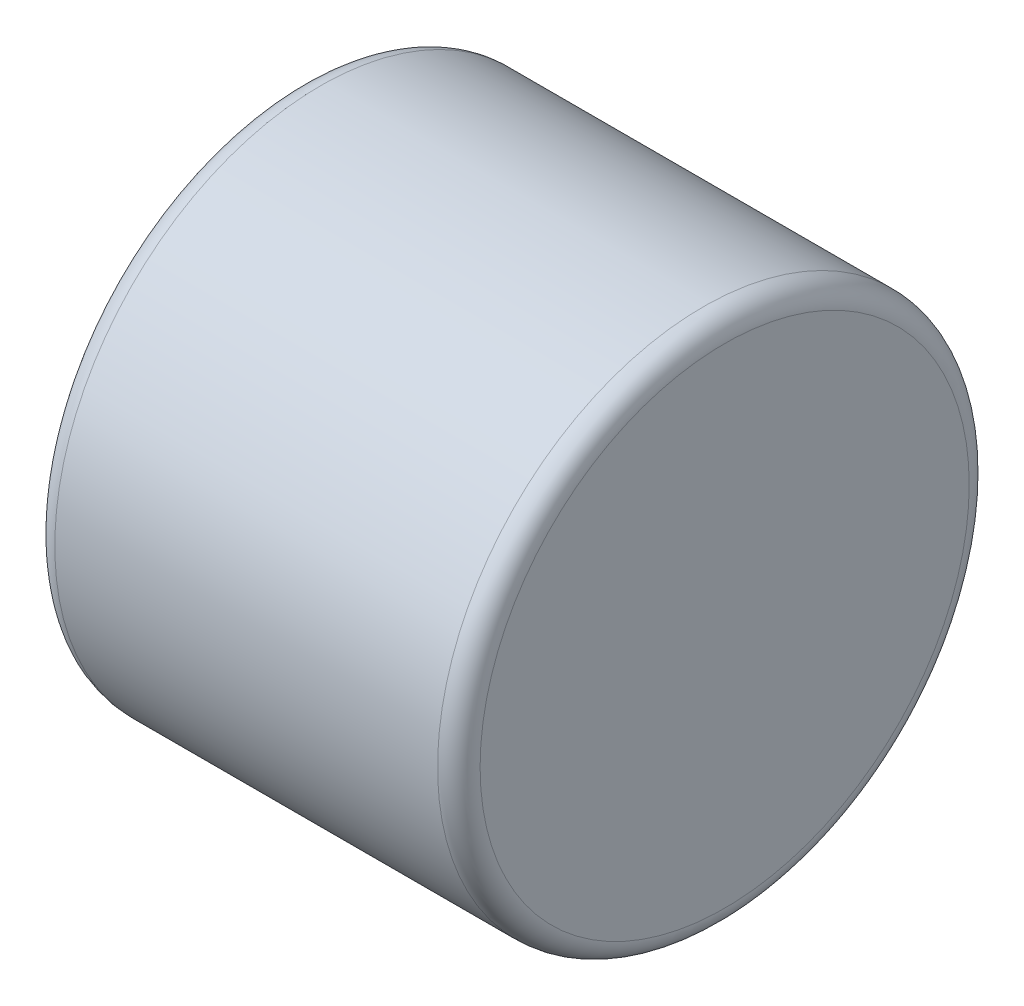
SolidWorks part; units mm, degrees
ref_plane "Front" through (0, 0, 0) normal (0, 0, 1) x (1, 0, 0)
ref_plane "Top" through (0, 0, 0) normal (0, 1, 0) x (1, 0, 0)
ref_plane "Right" through (0, 0, 0) normal (1, 0, 0) x (0, 0, -1)
sketch "Sketch1" plane through (0, 0, 0) normal (1, 0, 0) x (0, 0, -1)
  circle A0 centre (0, 0) radius 1.5875
  dimension "D1" = 3.175
extrude "Extrude1" add sketch "Sketch1" along normal blind 2.54
fillet "Fillet1" radius 0.127 2 edges at (0, 0, -1.5875) (2.54, 0, -1.5875)
